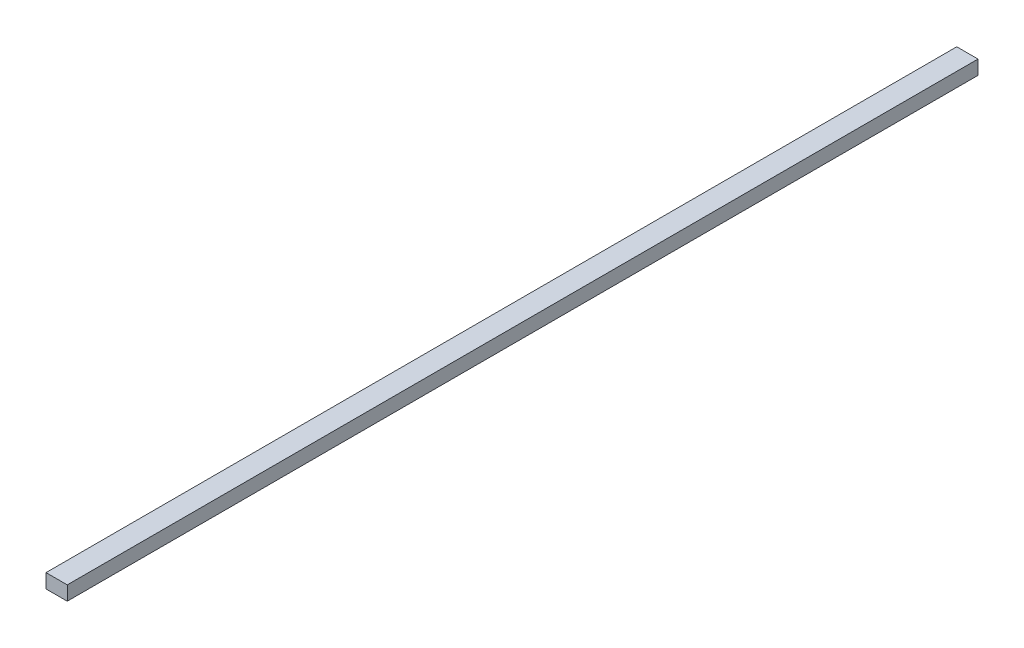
SolidWorks part; units mm, degrees
ref_plane "Front Plane" through (0, 0, 0) normal (0, 0, 1) x (1, 0, 0)
ref_plane "Top Plane" through (0, 0, 0) normal (0, 1, 0) x (1, 0, 0)
ref_plane "Right Plane" through (0, 0, 0) normal (1, 0, 0) x (0, 0, -1)
sketch "Sketch1" plane through (0, 0, 0) normal (0, 0, 1) x (1, 0, 0)
  line L1 (21, -14) -> (-21, -14)
  line L2 (21, -14) -> (21, 14)
  line L3 (21, 14) -> (-21, 14)
  line L4 (-21, -14) -> (-21, 14)
  line L5 (21, -14) -> (-21, 14) construction
  line L6 (21, 14) -> (-21, -14) construction
  point P0 (0, 0)
  dimension "D1" = 42
  dimension "D2" = 28
extrude "Boss-Extrude1" add sketch "Sketch1" along normal blind 1800
